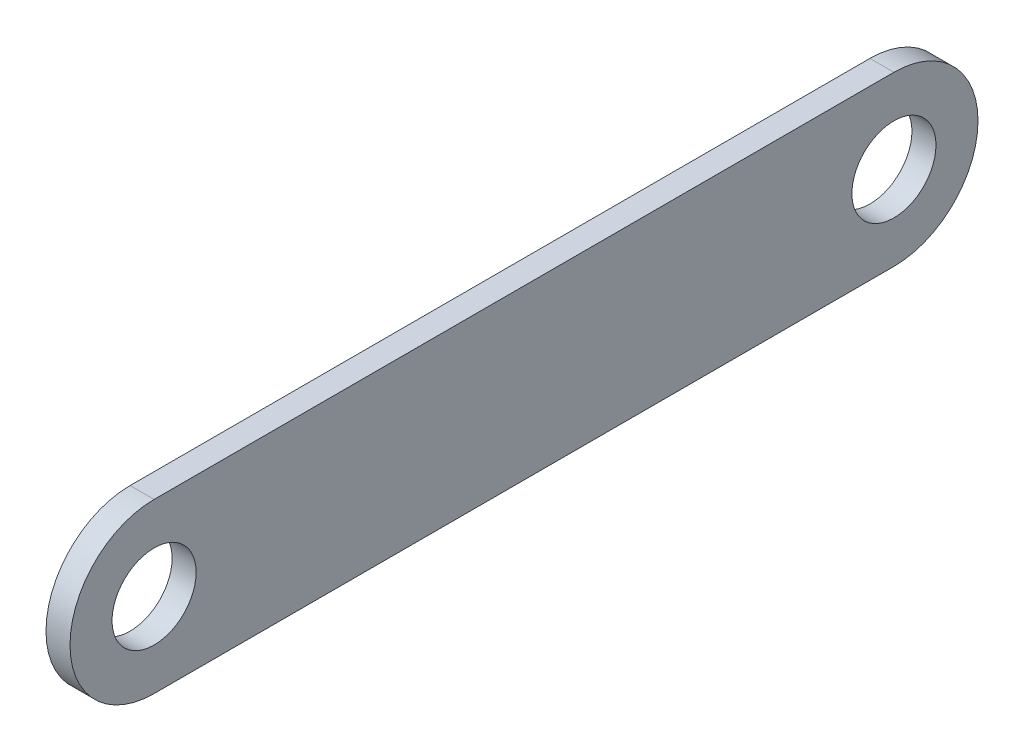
SolidWorks part; units mm, degrees
ref_plane "Front" through (0, 0, 0) normal (0, 0, 1) x (1, 0, 0)
ref_plane "Top" through (0, 0, 0) normal (0, 1, 0) x (1, 0, 0)
ref_plane "Right" through (0, 0, 0) normal (1, 0, 0) x (0, 0, -1)
sketch "Sketch1" plane through (0, 0, 0) normal (1, 0, 0) x (0, 0, -1)
  line L0 (308, 0) -> (0, 0) construction
  line L1 (308, -35) -> (0, -35)
  line L2 (308, 35) -> (0, 35)
  circle A0 centre (0, 0) radius 17.5
  arc A1 (308, -35) -> (308, 35) centre (308, 0) ccw
  arc A2 (0, 35) -> (0, -35) centre (0, 0) ccw
  circle A3 centre (308, 0) radius 17.5
  point P4 (154, 0)
  dimension "D2" = 35
  dimension "D1" = 70
  dimension "D3" = 308
extrude "Boss-Extrude2" add sketch "Sketch1" along normal blind 10 contours A0 | L2 A2 L1 A1 | A3
